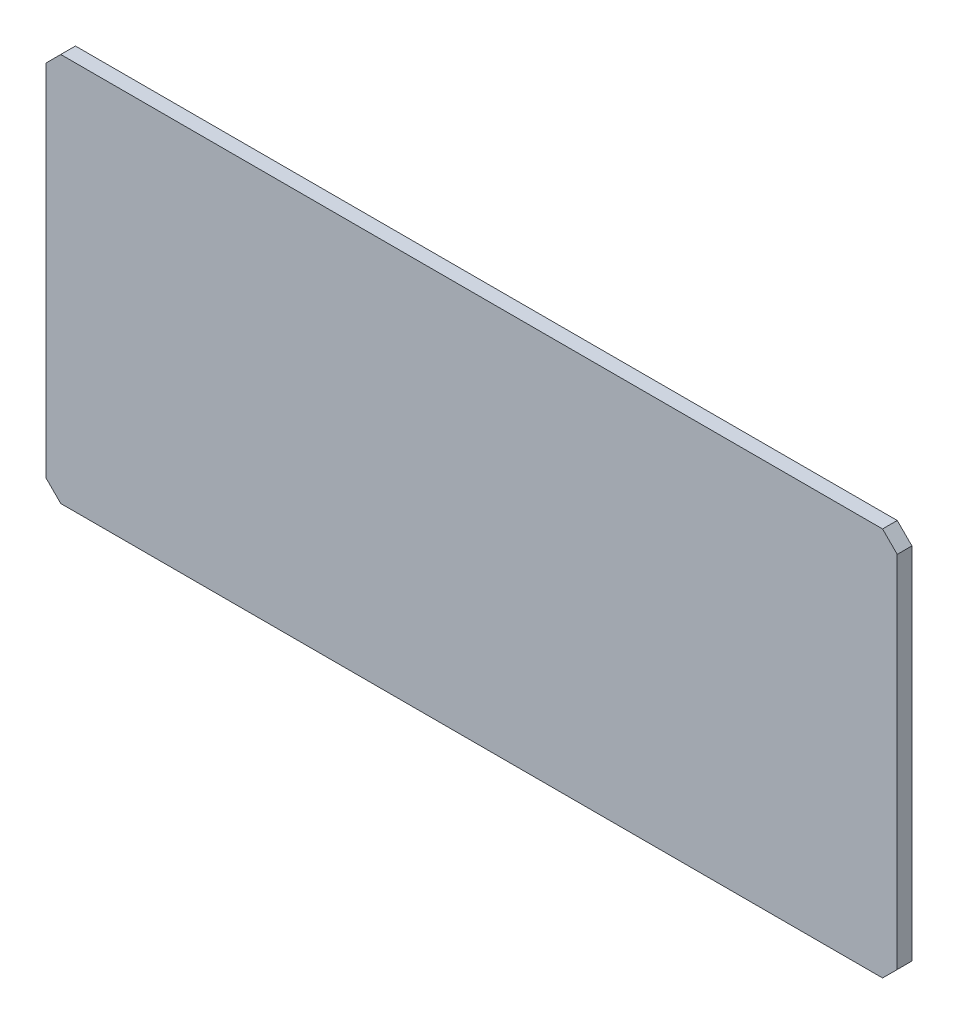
SolidWorks part; units mm, degrees
ref_plane "Plan de face" through (0, 0, 0) normal (0, 0, 1) x (1, 0, 0)
ref_plane "Plan de dessus" through (0, 0, 0) normal (0, 1, 0) x (1, 0, 0)
ref_plane "Plan de droite" through (0, 0, 0) normal (1, 0, 0) x (0, 0, -1)
sketch "Esquisse1" plane through (0, 0, 0) normal (0, 0, 1) x (1, 0, 0)
  line L1 (0, 0) -> (-116, 0)
  line L2 (0, 0) -> (0, 53)
  line L3 (0, 53) -> (-116, 53)
  line L4 (-116, 0) -> (-116, 53)
  dimension "D1" = 53
  dimension "D2" = 116
extrude "Extrusion1" add sketch "Esquisse1" along normal blind 2
chamfer "Chanfrein1" distance 2 angle 45 4 edges at (0, 0, 1) (0, 53, 1) (-116, 0, 1) (-116, 53, 1)
